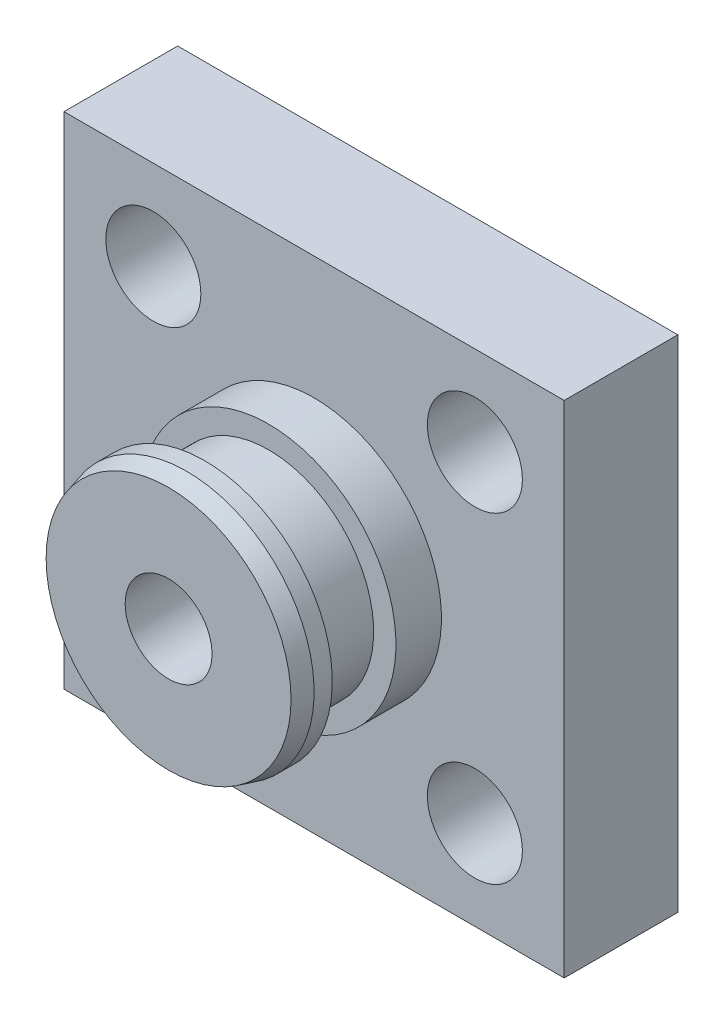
SolidWorks part; units mm, degrees
ref_plane "Front Plane" through (0, 0, 0) normal (0, 0, 1) x (1, 0, 0)
ref_plane "Top Plane" through (0, 0, 0) normal (0, 1, 0) x (1, 0, 0)
ref_plane "Right Plane" through (0, 0, 0) normal (1, 0, 0) x (0, 0, -1)
sketch "Sketch1" plane through (0, 0, 0) normal (0, 0, 1) x (1, 0, 0)
  line L0 (0, 0) -> (0, 13.97) construction
  line L1 (-13.97, 13.97) -> (13.97, 13.97)
  line L2 (13.97, 13.97) -> (13.97, -13.97)
  line L3 (-13.97, 13.97) -> (-13.97, -13.97)
  line L4 (0, 0) -> (13.97, 0) construction
  line L5 (-13.97, -13.97) -> (13.97, -13.97)
  point P9 (-13.97, 0)
  dimension "D2" = 13.97
  dimension "D3" = 13.97
extrude "base" add sketch "Sketch1" along normal blind 6.35
sketch "Sketch2" plane through (0, 0, 6.35) normal (0, 0, 1) x (1, 0, 0)
  circle A0 centre (0, 0) radius 7.112
  dimension "D1" = 14.224
extrude "plug_dia1" add sketch "Sketch2" along normal blind 2.54
sketch "Sketch3" plane through (0, 0, 8.89) normal (0, 0, 1) x (1, 0, 0)
  circle A0 centre (0, 0) radius 5.8674
  dimension "D1" = 11.7348
extrude "groove_dia" add sketch "Sketch3" along normal blind 3.556
sketch "Sketch4" plane through (0, 0, 12.446) normal (0, 0, 1) x (1, 0, 0)
  circle A0 centre (0, 0) radius 7.112
  dimension "D1" = 14.224
extrude "plug_dia2" add sketch "Sketch4" along normal blind 2.032
sketch "Sketch12" plane through (0, 0, 6.35) normal (0, 0, 1) x (1, 0, 0)
  line L0 (0, 0) -> (15.24, 0) construction
  line L1 (0, 0) -> (8.9803, 8.9803) construction
  circle A0 centre (0, 0) radius 12.7 construction
  circle A1 centre (8.9803, 8.9803) radius 2.6543
  circle A2 centre (8.9803, -8.9803) radius 2.6543
  circle A3 centre (-8.9803, -8.9803) radius 2.6543
  circle A4 centre (-8.9803, 8.9803) radius 2.6543
  dimension "D3" = 5.3086
  dimension "D4" = 25.4
  dimension "D2" = 45
extrude "bolt_circle" cut sketch "Sketch12" against normal through all
chamfer "Chamfer1" distance 1.016 angle 15 1 edges at (7.112, 0, 14.478)
sketch "Sketch15" plane through (0, 0, 0) normal (0, 0, -1) x (-1, 0, 0)
  circle A0 centre (0, 0) radius 2.4257
  dimension "D1" = 4.8514
extrude "center_bore" cut sketch "Sketch15" against normal blind 50.8
sketch "Sketch16" plane through (0, 0, 0) normal (0, 0, -1) x (-1, 0, 0)
  circle A0 centre (0, 0) radius 3.2004
  dimension "D1" = 6.4008
extrude "Cut-Extrude2" cut sketch "Sketch16" against normal blind 5.08
